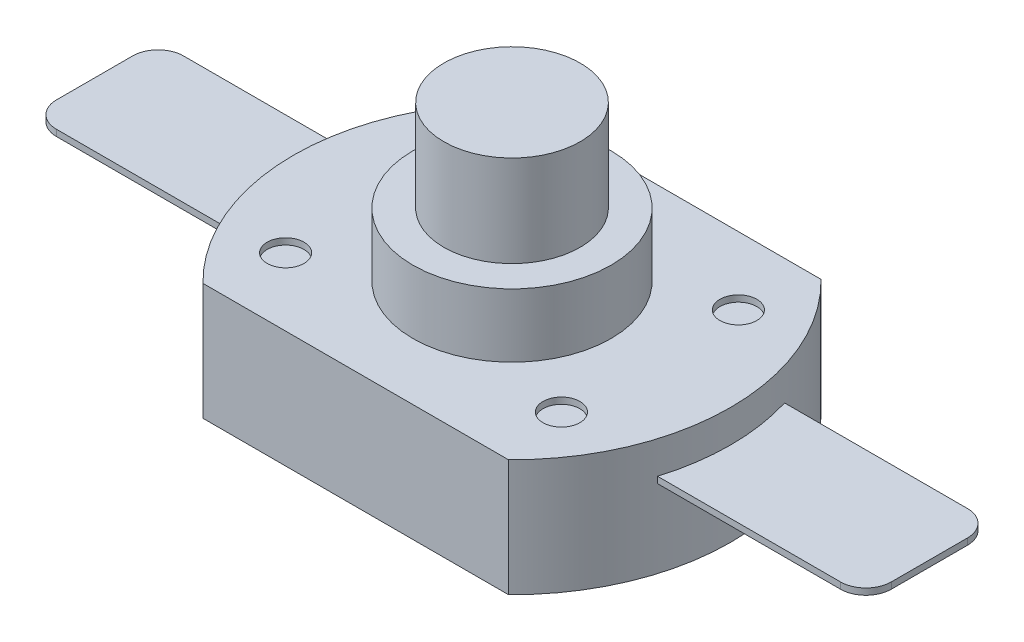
SolidWorks part; units mm, degrees
ref_plane "Plan de face" through (0, 0, 0) normal (0, 0, 1) x (1, 0, 0)
ref_plane "Plan de dessus" through (0, 0, 0) normal (0, 1, 0) x (1, 0, 0)
ref_plane "Plan de droite" through (0, 0, 0) normal (1, 0, 0) x (0, 0, -1)
sketch "Esquisse1" plane through (0, 0, 0) normal (0, 1, 0) x (1, 0, 0)
  line L0 (0, -14.3334) -> (0, 20.7935) construction
  line L1 (-6.0114, -6.15) -> (6.0114, -6.15)
  line L3 (6.0114, 6.15) -> (-6.0114, 6.15)
  line L5 (-8.6, 0) -> (8.6, 0) construction
  arc A0 (6.0114, -6.15) -> (6.0114, 6.15) centre (0, 0) ccw
  arc A1 (-6.0114, -6.15) -> (-6.0114, 6.15) centre (0, 0) cw
  dimension "D1" = 17.2
  dimension "D2" = 12.3
extrude "Extrusion1" add sketch "Esquisse1" along normal blind 4.6
sketch "Esquisse2" plane through (0, 4.6, 0) normal (0, 1, 0) x (-1, 0, 0)
  circle A0 centre (0, 0) radius 3.9
  dimension "D1" = 7.8
extrude "Extrusion2" add sketch "Esquisse2" along normal blind 2.5
sketch "Esquisse3" plane through (0, 7.1, 0) normal (0, 1, 0) x (-1, 0, 0)
  circle A0 centre (0, 0) radius 2.683
  dimension "D1" = 5.366
extrude "Extrusion3" add sketch "Esquisse3" along normal blind 3.6
ref_plane "Plan1" through (0, 3.07, 0) normal (0, 1, 0) x (-1, 0, 0)
sketch "Esquisse4" plane through (0, 3.07, 0) normal (0, 1, 0) x (-1, 0, 0)
  line L0 (0, 0) -> (16.4286, 0) construction
  line L1 (8.2286, 2.5) -> (15.4286, 2.5)
  line L2 (8.2286, 2.5) -> (8.2286, -2.5)
  line L3 (8.2286, -2.5) -> (15.4286, -2.5)
  line L4 (16.4286, 1.5) -> (16.4286, -1.5)
  line L5 (0, 0) -> (0, 10.4202) construction
  line L6 (-16.4286, 1.5) -> (-16.4286, -1.5)
  line L7 (-8.2286, -2.5) -> (-15.4286, -2.5)
  line L8 (-8.2286, 2.5) -> (-8.2286, -2.5)
  line L9 (-8.2286, 2.5) -> (-15.4286, 2.5)
  arc A0 (6.0114, -6.15) -> (6.0114, 6.15) centre (0, 0) ccw construction
  arc A1 (15.4286, 2.5) -> (16.4286, 1.5) centre (15.4286, 1.5) cw
  arc A2 (15.4286, -2.5) -> (16.4286, -1.5) centre (15.4286, -1.5) ccw
  arc A3 (-15.4286, -2.5) -> (-16.4286, -1.5) centre (-15.4286, -1.5) cw
  arc A4 (-15.4286, 2.5) -> (-16.4286, 1.5) centre (-15.4286, 1.5) ccw
  point P12 (16.4286, 2.5)
  point P24 (-16.4286, 2.5)
  dimension "D3" = 1
  dimension "D1" = 5
  dimension "D2" = 8.2
extrude "Extrusion4" add sketch "Esquisse4" along normal blind 0.25
sketch "Esquisse5" plane through (0, 4.6, 0) normal (0, 1, 0) x (-1, 0, 0)
  line L0 (0, 0) -> (-12.5283, 0) construction
  line L1 (0, 0) -> (0, 10.1046) construction
  circle A0 centre (-5.4278, 3.482) radius 0.7258
  circle A1 centre (-5.4278, -3.482) radius 0.7258
  circle A2 centre (5.4278, -3.482) radius 0.7258
  circle A3 centre (5.4278, 3.482) radius 0.7258
extrude "Enlèv. mat.-Extru.1" cut sketch "Esquisse5" against normal blind 0.25
